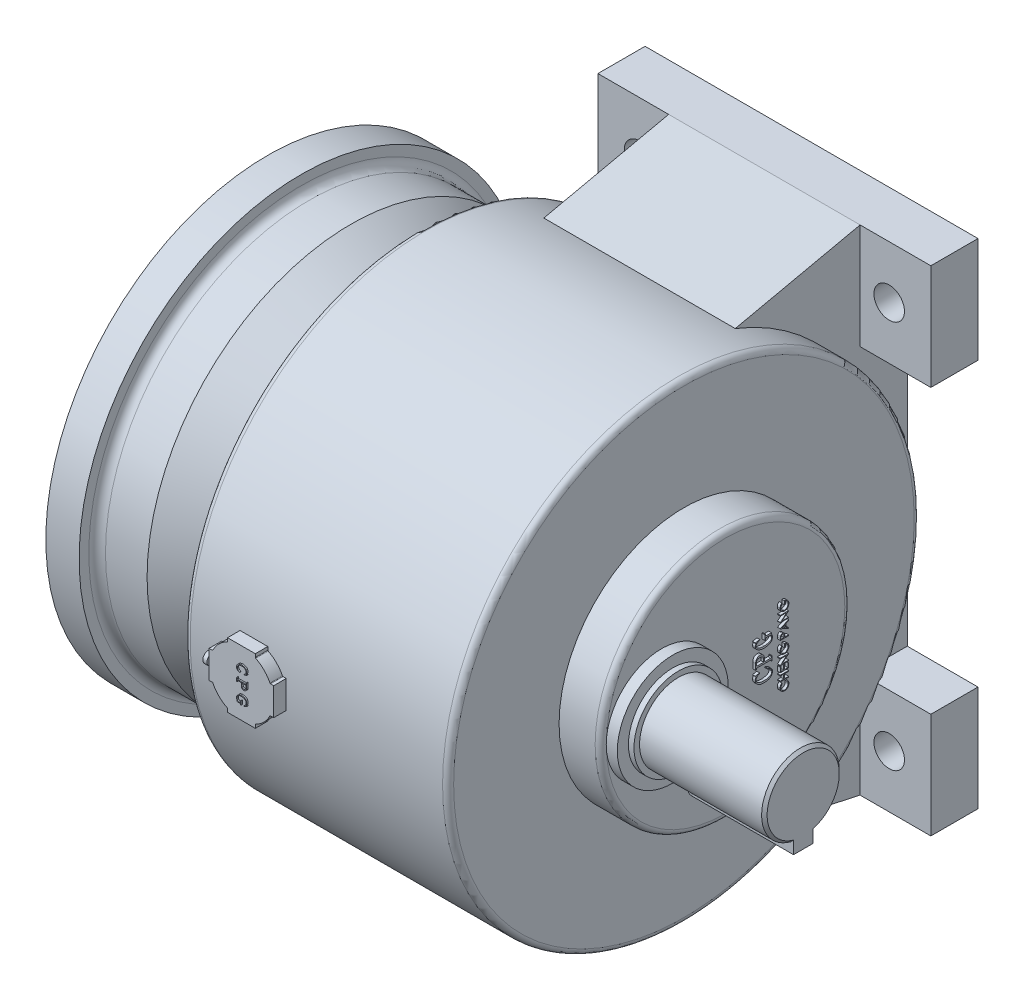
SolidWorks part; units mm, degrees
ref_plane "前视基准面" through (0, 0, 0) normal (0, 0, 1) x (1, 0, 0)
ref_plane "上视基准面" through (0, 0, 0) normal (0, 1, 0) x (1, 0, 0)
ref_plane "右视基准面" through (0, 0, 0) normal (1, 0, 0) x (0, 0, -1)
ref_plane "基准面1" through (0, 0, -116) normal (0, 0, 1) x (1, 0, 0)
sketch "草图1" plane through (0, 0, 0) normal (0, 1, 0) x (1, 0, 0)
  line L0 (0, 0) -> (33.1729, 0) construction
  line L1 (0, 0) -> (0, -14)
  line L2 (0, -14) -> (-45, -14)
  line L3 (-45, -14) -> (-45, -16)
  line L4 (-45, -16) -> (-47, -16)
  line L5 (-47, -16) -> (-47, -20)
  line L6 (-47, -20) -> (-51, -20)
  line L7 (-51, -20) -> (-51, 0)
  line L8 (-51, 0) -> (0, 0)
  dimension "D1" = 45
  dimension "D2" = 28
  dimension "D3" = 32
  dimension "D4" = 2
  dimension "D5" = 40
  dimension "D6" = 4
revolve "旋转1" add sketch "草图1" angle 360 about L0
sketch "草图2" plane through (0, 0, 0) normal (0, 1, 0) x (1, 0, 0)
  line L0 (8.0167, 23) -> (-51, 23) construction
  line L1 (-51, 23) -> (-51, -22)
  line L2 (-51, 20) -> (-51, -20) construction
  line L3 (-51, -22) -> (-66, -22)
  line L4 (-66, -22) -> (-66, -62)
  line L5 (-66, -62) -> (-161, -62)
  line L6 (-161, -62) -> (-161, 23)
  line L11 (-51, 23) -> (-161, 23)
  line L13 (-103.125, 116) -> (103.125, 116) construction
  dimension "D1" = 23
  dimension "D2" = 90
  dimension "D3" = 15
  dimension "D4" = 178
  dimension "D5" = 95
revolve "旋转2" add sketch "草图2" angle 360 about L0
sketch "草图3" plane through (0, 0, -116) normal (0, 0, 1) x (1, 0, 0)
  line L0 (0, 0) -> (40.0459, 0) construction
  line L1 (-173, -51) -> (-53, -51)
  line L2 (-173, -51) -> (-173, -89)
  line L3 (-173, -89) -> (-53, -89)
  line L4 (-53, -51) -> (-53, -89)
  line L5 (0, -14) -> (0, 14) construction
  circle A0 centre (-68, -70) radius 5.5
  circle A1 centre (-158, -70) radius 5.5
  dimension "D2" = 140
  dimension "D3" = 11
  dimension "D4" = 90
  dimension "D6" = 68
  dimension "D8" = 38
  dimension "D1" = 178
  dimension "D5" = 120
  dimension "D7" = 15
extrude "拉伸2" add sketch "草图3" along normal blind 17
mirror "镜向2" about plane through (0, 0, 0) normal (0, 1, 0)
ref_plane "基准面4" through (-113, 0, 0) normal (1, 0, 0) x (0, 0, -1)
sketch "草图4" plane through (-113, 0, 0) normal (1, 0, 0) x (0, 0, -1)
  line L0 (99, 51) -> (116, 51) construction
  line L1 (99, 51) -> (116, 51)
  line L2 (99, 89) -> (99, 51) construction
  line L3 (99, 89) -> (99, 51)
  line L4 (99, -51) -> (116, -51) construction
  line L5 (99, -51) -> (116, -51)
  line L6 (99, -89) -> (99, -51) construction
  line L7 (99, -89) -> (99, -51)
  line L8 (116, 51) -> (116, -51)
  line L9 (99, 89) -> (54, 79.1454)
  line L11 (54, -79.1454) -> (99, -89)
  arc A1 (54, -79.1454) -> (54, 79.1454) centre (23, 0) ccw
  circle A2 centre (23, 0) radius 85 construction
  dimension "D1" = 45
extrude "拉伸3" add sketch "草图4" against normal mid plane 69
sketch "草图5" plane through (0, 0, 0) normal (0, 1, 0) x (1, 0, 0)
  line L0 (0, -3.5) -> (-36.5, -3.5)
  line L1 (0, -14) -> (0, 14) construction
  line L2 (-36.5, 3.5) -> (0, 3.5)
  line L3 (0, 3.5) -> (0, -3.5)
  line L4 (31.1, -13.7955) -> (31.1, 19.6443) construction
  arc A0 (-36.5, -3.5) -> (-36.5, 3.5) centre (-36.5, 0) cw
  dimension "D2" = 40
  dimension "D1" = 7
  dimension "D3" = 31.1
extrude "拉伸4" add sketch "草图5" against normal blind 17.1
fillet "圆角1" radius 2 3 edges at (-161, 0, -108) (-66, 0, -108) (-51, 0, -68)
chamfer "倒角1" distance 1 angle 45 1 edges at (0, 14, 0)
sketch "草圖1" plane through (0, 0, 0) normal (0, 1, 0) x (1, 0, 0)
  line L0 (-161, 23) -> (-208.5, 23)
  line L1 (-161, -38) -> (-161, 23)
  line L2 (-80.3334, 23) -> (-252.5704, 23) construction
  line L4 (-161, -38) -> (-166, -38)
  line L5 (-166, -38) -> (-186, -50.5)
  line L6 (-186, -50.5) -> (-201, -50.5)
  line L7 (-204, -53.5) -> (-204, -57)
  line L8 (-204, -57) -> (-216, -57)
  line L9 (-216, -57) -> (-216, -33)
  line L10 (-215, -32) -> (-212, -32)
  line L11 (-212, -32) -> (-212, -27.0871)
  line L12 (-191, -16.5606) -> (-191, -11)
  line L13 (-194, -8) -> (-209, -8)
  line L14 (-210, -7) -> (-210, 2)
  line L15 (-210, 2) -> (-208.8, 2)
  line L16 (-208.5, 2.3) -> (-208.5, 23)
  line L17 (-211.9137, -26.988) -> (-191, -24.0869)
  arc A0 (-201, -50.5) -> (-204, -53.5) centre (-201, -53.5) ccw
  arc A1 (-191, -24.0869) -> (-189.7461, -19.0001) centre (-191.3875, -21.2934) ccw
  arc A2 (-215, -32) -> (-216, -33) centre (-215, -33) ccw
  arc A3 (-211.9137, -26.988) -> (-212, -27.0871) centre (-211.9, -27.0871) ccw
  arc A4 (-189.7461, -19.0001) -> (-191, -16.5606) centre (-188, -16.5606) cw
  arc A5 (-191, -11) -> (-194, -8) centre (-194, -11) ccw
  arc A6 (-209, -8) -> (-210, -7) centre (-209, -7) cw
  arc A7 (-208.8, 2) -> (-208.5, 2.3) centre (-208.8, 2.3) ccw
  point P27 (-216, -32)
  point P30 (-212, -27)
  point P33 (-191, -18.5)
  point P38 (-210, -8)
  point P41 (-210, 3)
  dimension "D9" = 160
  dimension "D19" = 23
  dimension "D20" = 216
  dimension "D7" = 55
  dimension "D10" = 110
revolve "旋轉1" add sketch "草圖1" angle 360 about L2
sketch "草圖2" plane through (-216, 0, 0) normal (-1, 0, 0) x (0, 0, 1)
  line L0 (-107.0945, 0) -> (65.8288, 0) construction
  line L1 (-23, 84.2191) -> (-23, -84.9666) construction
  circle A0 centre (-23, 0) radius 65 construction
  circle A1 centre (-68.9619, 45.9619) radius 4
  circle A2 centre (22.9619, 45.9619) radius 4
  circle A3 centre (22.9619, -45.9619) radius 4
  circle A4 centre (-68.9619, -45.9619) radius 4
  dimension "D1" = 130
  dimension "D2" = 8
extrude "伸長1" cut sketch "草圖2" against normal blind 25
sketch "草圖5" plane through (-216, 0, 0) normal (-1, 0, 0) x (0, 0, 1)
  line L0 (-22.7357, 0.1095) -> (-88.9995, 0.1095) construction
  line L1 (-83.8691, 25.8875) -> (-64.1652, 5.6346)
  line L2 (-83.8691, -25.14) -> (-64.1013, -5.3652)
  line L3 (-63.1598, 10.8351) -> (-70.2309, 17.9061)
  line L4 (-40.5324, 47.6046) -> (-33.4613, 40.5336)
  line L5 (-69.4923, 35.1988) -> (-57.825, 46.866)
  line L6 (-48.5138, 61.2429) -> (-28.739, 41.475)
  line L7 (2.5138, 61.2429) -> (-17.7392, 41.539)
  line L8 (11.825, 46.866) -> (23.4923, 35.1988)
  line L10 (24.2309, 17.9061) -> (17.1598, 10.8351)
  line L11 (37.8691, 25.8875) -> (18.1013, 6.1127)
  line L12 (37.8691, -25.14) -> (18.1652, -4.8871)
  line L13 (23.4923, -34.4513) -> (11.825, -46.1185)
  line L15 (-5.4676, -46.8571) -> (-12.5387, -39.7861)
  line L16 (2.5138, -60.4954) -> (-17.261, -40.7275)
  line L17 (-48.5138, -60.4954) -> (-28.2608, -40.7914)
  line L18 (-57.825, -46.1185) -> (-69.4923, -34.4513)
  line L20 (-70.2309, -17.1586) -> (-63.1598, -10.0876)
  line L22 (-12.5387, 40.5336) -> (-5.4676, 47.6046)
  line L24 (17.1598, -10.0876) -> (24.2309, -17.1586)
  line L29 (-33.4613, -39.7861) -> (-40.5324, -46.8571)
  arc A0 (-83.8691, 25.8875) -> (-83.8691, -25.14) centre (-23, 0.3738) ccw
  arc A1 (-33.4613, 40.5336) -> (-63.1598, 10.8351) centre (-23, 0.3738) ccw
  arc A2 (17.1598, 10.8351) -> (-12.5387, 40.5336) centre (-23, 0.3738) ccw
  arc A3 (-64.1652, 5.6346) -> (-64.1013, -5.3652) centre (-23, 0.3738) ccw
  arc A4 (2.5138, 61.2429) -> (-48.5138, 61.2429) centre (-23, 0.3738) ccw
  arc A5 (-17.7392, 41.539) -> (-28.739, 41.475) centre (-23, 0.3738) ccw
  arc A6 (-12.5387, -39.7861) -> (17.1598, -10.0876) centre (-23, 0.3738) ccw
  arc A7 (37.8691, -25.14) -> (37.8691, 25.8875) centre (-23, 0.3738) ccw
  arc A8 (18.1652, -4.8871) -> (18.1013, 6.1127) centre (-23, 0.3738) ccw
  arc A9 (-63.1598, -10.0876) -> (-33.4613, -39.7861) centre (-23, 0.3738) ccw
  arc A10 (-48.5138, -60.4954) -> (2.5138, -60.4954) centre (-23, 0.3738) ccw
  arc A11 (-28.2608, -40.7914) -> (-17.261, -40.7275) centre (-23, 0.3738) ccw
  spline S0 degree 2 poles (-70.2309, 17.9061) (-75.0713, 26.7678) (-69.4923, 35.1988) knots 0 0 0 1 1 1
  spline S1 degree 2 poles (-40.5324, 47.6046) (-49.3941, 52.445) (-57.825, 46.866) knots 0 0 0 1 1 1
  spline S2 degree 2 poles (24.2309, 17.9061) (29.0713, 26.7678) (23.4923, 35.1988) knots 0 0 0 1 1 1
  spline S3 degree 2 poles (-5.4676, 47.6046) (3.3941, 52.445) (11.825, 46.866) knots 0 0 0 1 1 1
  spline S4 degree 2 poles (-5.4676, -46.8571) (3.3941, -51.6975) (11.825, -46.1185) knots 0 0 0 1 1 1
  spline S5 degree 2 poles (24.2309, -17.1586) (29.0713, -26.0203) (23.4923, -34.4513) knots 0 0 0 1 1 1
  spline S6 degree 2 poles (-70.2309, -17.1586) (-75.0713, -26.0203) (-69.4923, -34.4513) knots 0 0 0 1 1 1
  spline S7 degree 2 poles (-40.5324, -46.8571) (-49.3941, -51.6975) (-57.825, -46.1185) knots 0 0 0 1 1 1
extrude "伸長2" cut sketch "草圖5" against normal blind 39 draft 1
sketch "草圖7" plane through (-177, 0, 0) normal (-1, 0, 0) x (0, 0, 1)
  circle A0 centre (-23, 0) radius 51.5 construction
  circle A1 centre (-59.416, 36.416) radius 3
  circle A2 centre (13.416, 36.416) radius 3
  circle A3 centre (13.416, -36.416) radius 3
  circle A4 centre (-59.416, -36.416) radius 3
  dimension "D1" = 103
  dimension "D2" = 6
extrude "伸長6" cut sketch "草圖7" against normal blind 11
sketch "草圖10" plane through (-208.5, 0, 0) normal (-1, 0, 0) x (0, 0, 1)
  line L0 (-23, -23.7231) -> (-23, 30.1834) construction
  line L1 (-13.7, -2.5) -> (-13.7, 2.5)
  line L2 (-13.7, -2.5) -> (-16.4617, -2.5)
  line L4 (-13.7, 2.5) -> (-16.4617, 2.5)
  line L5 (-47.2846, 0) -> (2.9622, 0) construction
  circle A0 centre (-23, 0) radius 12.5 construction
  arc A2 (-16.4617, 2.5) -> (-16.4617, -2.5) centre (-23, 0) ccw
  dimension "D1" = 25
  dimension "D2" = 5
  dimension "D5" = 14
  dimension "D4" = 9.3
extrude "伸長7" cut sketch "草圖10" against normal blind 28
sketch "草圖12" plane through (-208.5, 0, 0) normal (-1, 0, 0) x (0, 0, 1)
  line L0 (-13.7, -2.5) -> (-16.4617, -2.5) construction
  line L1 (-13.7, -2.5) -> (-13.7, 2.5) construction
  line L2 (-13.7, 2.5) -> (-16.4617, 2.5) construction
  line L3 (-13.7, -2.5) -> (-16.4617, -2.5)
  line L4 (-13.7, -2.5) -> (-13.7, 2.5)
  line L5 (-13.7, 2.5) -> (-16.4617, 2.5)
  arc A0 (-16.4617, 2.5) -> (-16.4617, -2.5) centre (-23, 0) ccw construction
  circle A1 centre (-23, 0) radius 12.5 construction
  arc A2 (-16.4617, 2.5) -> (-16.4617, -2.5) centre (-23, 0) ccw
  circle A3 centre (-23, 0) radius 12.5
extrude "伸長8" add sketch "草圖12" along normal blind 1
sketch "草圖13"
extrude "伸長9" add sketch "草圖13" along normal blind 1
ref_plane "平面1" through (0, 0, 66.5) normal (0, 0, 1) x (1, 0, 0)
sketch "草圖14" plane through (0, 0, 66.5) normal (0, 0, 1) x (1, 0, 0)
  line L0 (-141, 11.65) -> (-131, 11.65)
  line L1 (-141, 11.65) -> (-141, 10.5119)
  line L2 (-131, 11.65) -> (-131, 10.5119)
  line L3 (-141, -10.5119) -> (-141, -11.65)
  line L4 (-131, -10.5119) -> (-131, -11.65)
  line L5 (-147.65, 5) -> (-146.5119, 5)
  line L6 (-147.65, -5) -> (-146.5119, -5)
  line L7 (-147.65, -5) -> (-147.65, 5)
  line L8 (-141, -11.65) -> (-141, -10.5119)
  line L9 (-131, -11.65) -> (-131, -10.5119)
  line L10 (-131, -11.65) -> (-141, -11.65)
  line L11 (-124.35, -5) -> (-125.4881, -5)
  line L12 (-124.35, 5) -> (-125.4881, 5)
  line L13 (-124.35, 5) -> (-124.35, -5)
  arc A0 (-141.1383, 10.2882) -> (-146.2882, 5.1383) centre (-136, 0) ccw
  arc A1 (-141.1383, 10.2882) -> (-141, 10.5119) centre (-141.25, 10.5119) ccw
  arc A2 (-131, 10.5119) -> (-130.8617, 10.2882) centre (-130.75, 10.5119) ccw
  arc A3 (-146.5119, 5) -> (-146.2882, 5.1383) centre (-146.5119, 5.25) ccw
  arc A4 (-146.2882, -5.1383) -> (-146.5119, -5) centre (-146.5119, -5.25) ccw
  arc A5 (-141, -10.5119) -> (-141.1383, -10.2882) centre (-141.25, -10.5119) ccw
  arc A6 (-130.8617, -10.2882) -> (-131, -10.5119) centre (-130.75, -10.5119) ccw
  arc A7 (-125.4881, -5) -> (-125.7118, -5.1383) centre (-125.4881, -5.25) ccw
  arc A8 (-125.7118, 5.1383) -> (-125.4881, 5) centre (-125.4881, 5.25) ccw
  arc A9 (-125.7118, 5.1383) -> (-130.8617, 10.2882) centre (-136, 0) ccw
  arc A10 (-146.2882, -5.1383) -> (-141.1383, -10.2882) centre (-136, 0) ccw
  arc A11 (-130.8617, -10.2882) -> (-125.7118, -5.1383) centre (-136, 0) ccw
  dimension "D1" = 11.5
extrude "伸長10" add sketch "草圖14" against normal blind 4.5 separate body contours A6 A11 A7 L11 L13 L12 A8 A9 A2 L2 L0 L1 A1 A0 A3 L5 L7 L6 A4 A10 A5 L3 L10 L4
sketch "草圖15"
extrude "伸長11" add sketch "草圖15" along normal blind 0.5
sketch "草圖16" plane through (0, 0, 0) normal (0, 1, 0) x (1, 0, 0)
  line L0 (-150.1623, -64.25) -> (-142.1623, -64.25)
  line L1 (-150.1623, -64.25) -> (-150.1623, -62.25)
  line L2 (-148.6623, -63) -> (-148.6623, -62.25)
  line L13 (-146.6623, -63) -> (-142.1623, -63.25)
  line L15 (-148.6623, -63) -> (-146.6623, -63)
  line L23 (-150.1623, -62.25) -> (-148.6623, -62.25)
  line L24 (-146.6623, -64.25) -> (-146.6623, -63)
  line L25 (-142.1623, -64.25) -> (-142.1623, -63.25)
revolve "旋轉2" add sketch "草圖16" angle 360 about L0
equation "\"D3@草图1\"=\"D2@草图1\"+4"
equation "\"D1@拉伸4\"=\"D3@草图5\"-\"D2@草图1\"/2"
equation "\"D7@草图3\"=(\"D5@草图3\"-\"D4@草图3\")/2"
equation "\"D8@草图3\" = \"D1@草图3\"-\"D2@草图3\""
equation "\"D5@草图2\" = \"D5@草图3\"- 25"
equation "\"D1@基准面4\" = \"D5@草图3\"/2"
equation "\"D1@拉伸3\" = \"D4@草图3\"-\"D3@草图3\"-10"
